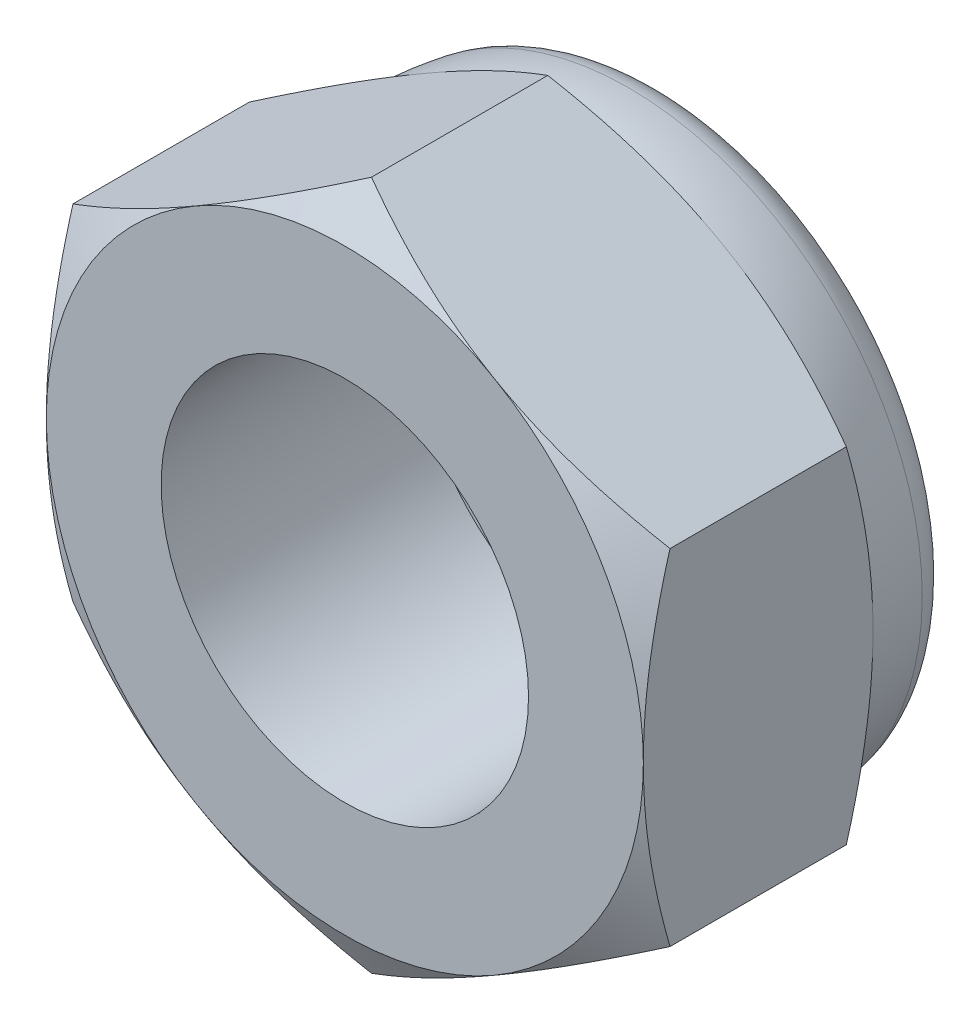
SolidWorks part; units mm, degrees
ref_plane "Plan1" through (0, 0, 0) normal (0, 0, 1) x (1, 0, 0)
ref_plane "Plan2" through (0, 0, 0) normal (0, 1, 0) x (1, 0, 0)
ref_plane "Plan3" through (0, 0, 0) normal (1, 0, 0) x (0, 0, -1)
sketch "Esquisse1" plane through (0, 0, 0) normal (0, 0, 1) x (1, 0, 0)
  line L0 (0, 0) -> (6.5, 0) construction
  line L1 (6.5, -3.7528) -> (6.5, 3.7528)
  line L2 (0, 0) -> (6.5, 3.7528) construction
  line L3 (0, 0) -> (0, 7.5056) construction
  line L4 (6.5, 3.7528) -> (0, 7.5056)
  line L5 (6.5, -3.7528) -> (0, -7.5056)
  line L6 (-6.5, -3.7528) -> (0, -7.5056)
  line L7 (-6.5, -3.7528) -> (-6.5, 3.7528)
  line L8 (-6.5, 3.7528) -> (0, 7.5056)
  circle A0 centre (0, 0) radius 6.5 construction
  circle A1 centre (0, 0) radius 7.5056 construction
  dimension "D2" = 13
  dimension "D1" = 30
extrude "Base-Extrusion" add sketch "Esquisse1" against normal blind 5
sketch "Esquisse2" plane through (0, 0, 0) normal (0, 1, 0) x (1, 0, 0)
  line L0 (-6.5, 0) -> (-11.8301, 0)
  line L1 (0, 5) -> (0, 0) construction
  line L2 (-6.5, 5) -> (-11.8301, 5)
  line L3 (-11.8301, 5) -> (-11.8301, 0)
  line L5 (-10.8301, 2.5) -> (-6.5, 5)
  line L6 (0, 5) -> (0, 0) construction
  line L7 (-6.5, 0) -> (-10.8301, 2.5)
  dimension "D1" = 30
  dimension "D2" = 1
  dimension "D3" = 30
revolve "Enlèvement de matière-Révolution1" cut sketch "Esquisse2" angle 360 about L6
sketch "Esquisse4" plane through (0, 0, 0) normal (0, 1, 0) x (1, 0, 0)
  line L0 (0, 0) -> (0, 11.5) construction
  line L2 (0, 11.5) -> (0, 5)
  line L3 (0, 5) -> (-6.5, 5)
  arc A0 (0, 11.5) -> (-6.5, 5) centre (0, 5) ccw
  dimension "D1" = 11.5
revolve "Boss.-Révol.1" add sketch "Esquisse4" angle 360 about L0
ref_plane "Plan4" through (0, 0, -7) normal (0, 0, 1) x (1, 0, 0)
sketch "Esquisse5" plane through (0, 0, -7) normal (0, 0, 1) x (1, 0, 0)
  arc A6 (6.5, 0) -> (3.25, 5.6292) centre (0, 0) ccw
  arc A7 (3.25, -5.6292) -> (6.5, 0) centre (0, 0) ccw
  arc A8 (-3.25, -5.6292) -> (3.25, -5.6292) centre (0, 0) ccw
  arc A9 (-6.5, 0) -> (-3.25, -5.6292) centre (0, 0) ccw
  arc A10 (-3.25, 5.6292) -> (-6.5, 0) centre (0, 0) ccw
  arc A11 (3.25, 5.6292) -> (-3.25, 5.6292) centre (0, 0) ccw
  arc A12 (6.5, 0) -> (3.25, 5.6292) centre (0, 0) ccw
  arc A13 (3.25, -5.6292) -> (6.5, 0) centre (0, 0) ccw
  arc A14 (-3.25, -5.6292) -> (3.25, -5.6292) centre (0, 0) ccw
  arc A15 (-6.5, 0) -> (-3.25, -5.6292) centre (0, 0) ccw
  arc A16 (-3.25, 5.6292) -> (-6.5, 0) centre (0, 0) ccw
  arc A17 (3.25, 5.6292) -> (-3.25, 5.6292) centre (0, 0) ccw
  dimension "D1" = 0
extrude "Enlèv. mat.-Extru.2" cut sketch "Esquisse5" against normal through all
fillet "Congé1" radius 1 1 edges at (6.1847, 0, -7)
sketch "Esquisse3" plane through (0, 0, 0) normal (0, 0, 1) x (1, 0, 0)
  circle A0 centre (0, 0) radius 4
  dimension "D1" = 8
extrude "Enlèv. mat.-Extru.1" cut sketch "Esquisse3" against normal through all
ref_axis "Axe1" through (0, 0, -32.4449) along (0, 0, 1)
sketch "Esquisse6" plane through (0, 0, 0) normal (0, 1, 0) x (1, 0, 0)
  line L0 (4, 0) -> (4, 7) construction
  line L1 (4, 7.1) -> (3.5, 7.1)
  line L2 (4, 7.1) -> (4, 5.6)
  line L3 (4, 5.6) -> (3.5, 5.6)
  line L4 (3.5, 7.1) -> (3.5, 5.6)
  line L7 (4, 7) -> (-4, 7) construction
  dimension "D1" = 1.5
  dimension "D2" = 0.5
  dimension "D3" = 0.1
revolve "Révolution2" add sketch "Esquisse6" angle 360 about axis through (0, 0, -32.4449) along (0, 0, 1)
